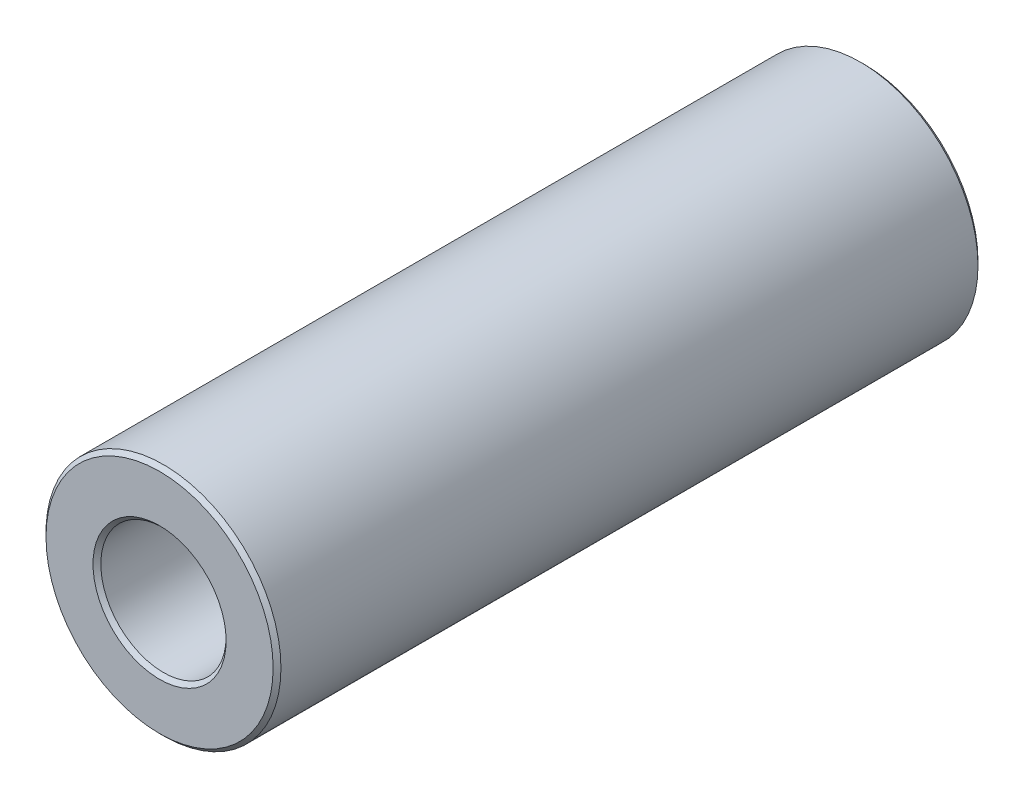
SolidWorks part; units mm, degrees
ref_plane "Front Plane" through (0, 0, 0) normal (0, 0, 1) x (1, 0, 0)
ref_plane "Top Plane" through (0, 0, 0) normal (0, 1, 0) x (1, 0, 0)
ref_plane "Right Plane" through (0, 0, 0) normal (1, 0, 0) x (0, 0, -1)
sketch "Sketch1" plane through (0, 0, 0) normal (0, 0, 1) x (1, 0, 0)
  circle A0 centre (0, 0) radius 3
  circle A1 centre (0, 0) radius 1.6
  dimension "D1" = 6
  dimension "D2" = 3.2
extrude "Boss-Extrude2" add sketch "Sketch1" along normal mid plane 18
chamfer "Chamfer3" distance 0.1 angle 45 4 edges at (3, 0, 9) (3, 0, -9) (1.6, 0, -9) (1.6, 0, 9)
